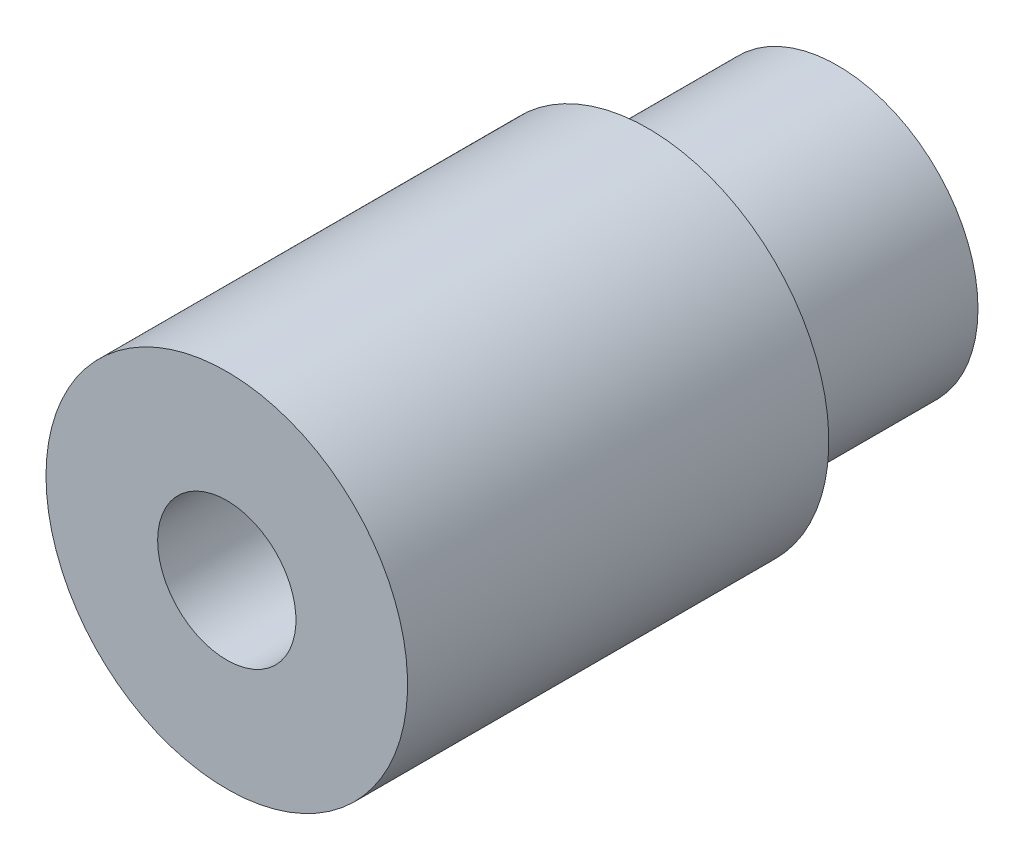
SolidWorks part; units mm, degrees
ref_plane "Front Plane" through (0, 0, 0) normal (0, 0, 1) x (1, 0, 0)
ref_plane "Top Plane" through (0, 0, 0) normal (0, 1, 0) x (1, 0, 0)
ref_plane "Right Plane" through (0, 0, 0) normal (1, 0, 0) x (0, 0, -1)
sketch "Sketch1" plane through (0, 0, 0) normal (0, 1, 0) x (1, 0, 0)
  line L0 (0, 83.4065) -> (0, -68.0147) construction
  line L1 (-2.5019, -36.7664) -> (-6.5405, -36.7664)
  line L2 (-6.5405, -36.7664) -> (-6.5405, -21.5264)
  line L3 (-6.5405, -21.5264) -> (-5.08, -21.5264)
  line L4 (-5.08, -21.5264) -> (-5.08, -14.6684)
  line L5 (-5.08, -14.6684) -> (-2.5019, -14.6684)
  line L6 (-2.5019, -14.6684) -> (-2.5019, -36.7664)
  dimension "D1" = 13.081
  dimension "D4" = 15.24
  dimension "D5" = 22.098
  dimension "D6" = 5.0038
  dimension "D7" = 10.16
revolve "Revolve1" add sketch "Sketch1" angle 360 about L0
sketch "Sketch2" plane through (0, 0, 14.6684) normal (0, 0, -1) x (-1, 0, 0)
  line L1 (0, 2.7496) -> (-2.3812, 1.3748)
  line L2 (-2.3812, 1.3748) -> (-2.3812, -1.3748)
  line L3 (-2.3812, -1.3748) -> (0, -2.7496)
  line L4 (0, -2.7496) -> (2.3812, -1.3748)
  line L5 (2.3812, -1.3748) -> (2.3812, 1.3748)
  line L6 (2.3812, 1.3748) -> (0, 2.7496)
  circle A0 centre (0, 0) radius 2.3813 construction
  dimension "D1" = 4.7625
extrude "Cut-Extrude1" [suppressed] cut sketch "Sketch2" against normal through all
